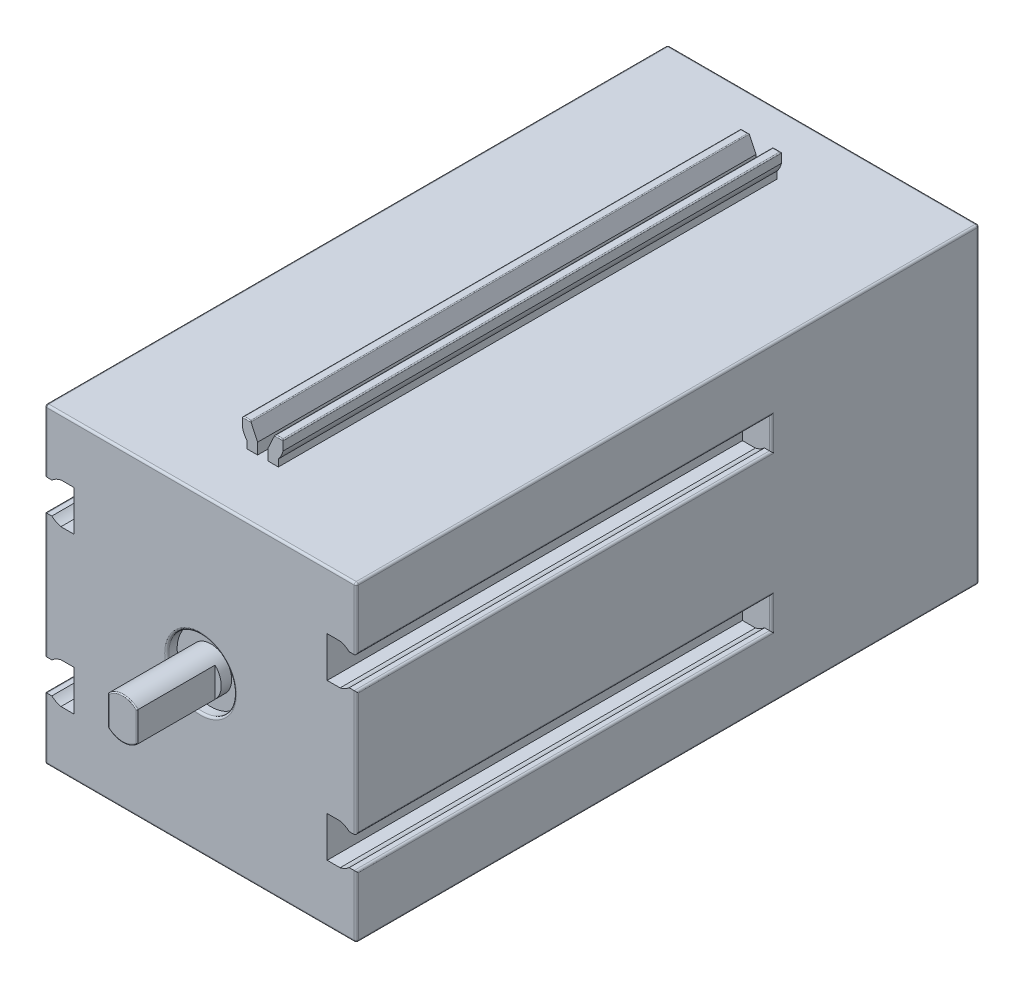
SolidWorks part; units mm, degrees
ref_plane "前视基准面" through (0, 0, 0) normal (0, 0, 1) x (1, 0, 0)
ref_plane "上视基准面" through (0, 0, 0) normal (0, 1, 0) x (1, 0, 0)
ref_plane "右视基准面" through (0, 0, 0) normal (1, 0, 0) x (0, 0, -1)
sketch "草图1" plane through (0, 0, 0) normal (0, 0, 1) x (1, 0, 0)
  line L1 (-15, 0) -> (15, 0)
  line L2 (-15, 0) -> (-15, 30)
  line L3 (-15, 30) -> (15, 30)
  line L4 (15, 0) -> (15, 30)
extrude "凸台-拉伸1" add sketch "草图1" against normal blind 60
sketch "草图2" plane through (0, 0, -60) normal (0, 0, -1) x (-1, 0, 0)
  line L0 (-9, 0.6771) -> (-9, 0)
  line L1 (15, 0) -> (-15, 0) construction
  line L2 (0, -2.0675) -> (0, 3.9748) construction
  line L3 (-6, 0.6771) -> (-6, 0)
  line L4 (-6, 0) -> (-9, 0)
  line L5 (-9.45, 2.8) -> (-5.55, 2.8)
  line L6 (-9.45, 2.8) -> (-9.45, 1.5556)
  line L7 (5.55, 2.8) -> (5.55, 1.5556)
  line L8 (-5.55, 2.8) -> (-5.55, 1.5556)
  line L9 (9.45, 2.8) -> (9.45, 1.5556)
  line L10 (9.45, 2.8) -> (5.55, 2.8)
  line L11 (6, 0) -> (9, 0)
  line L12 (6, 0.6771) -> (6, 0)
  line L13 (9, 0.6771) -> (9, 0)
  arc A0 (9.45, 1.5556) -> (9, 0.6771) centre (7.5, 2) cw
  arc A1 (-6, 0.6771) -> (-5.55, 1.5556) centre (-7.5, 2) ccw
  arc A2 (-9.45, 1.5556) -> (-9, 0.6771) centre (-7.5, 2) ccw
  arc A3 (6, 0.6771) -> (5.55, 1.5556) centre (7.5, 2) cw
extrude "切除-拉伸1" cut sketch "草图2" against normal blind 54.5
sketch "草图3" plane through (0, 0, -60) normal (0, 0, -1) x (-1, 0, 0)
  line L0 (-14.3229, 9) -> (-15, 9)
  line L1 (-15, 0) -> (-15, 30) construction
  line L2 (-15, 6) -> (-14.3229, 6)
  line L3 (-12.2, 9.45) -> (-12.2, 5.55)
  line L4 (-15, 9) -> (-15, 6)
  line L5 (-12.2, 5.55) -> (-13.4444, 5.55)
  line L6 (-12.2, 9.45) -> (-13.4444, 9.45)
  line L8 (-12.2, 20.55) -> (-13.4444, 20.55)
  line L9 (-12.2, 24.45) -> (-13.4444, 24.45)
  line L10 (-15, 21) -> (-15, 24)
  line L11 (-12.2, 20.55) -> (-12.2, 24.45)
  line L12 (-15, 24) -> (-14.3229, 24)
  line L13 (-14.3229, 21) -> (-15, 21)
  line L15 (14.3229, 21) -> (15, 21)
  line L16 (15, 24) -> (14.3229, 24)
  line L17 (12.2, 20.55) -> (12.2, 24.45)
  line L18 (15, 21) -> (15, 24)
  line L19 (12.2, 24.45) -> (13.4444, 24.45)
  line L20 (12.2, 20.55) -> (13.4444, 20.55)
  line L21 (12.2, 9.45) -> (13.4444, 9.45)
  line L22 (12.2, 5.55) -> (13.4444, 5.55)
  line L23 (15, 9) -> (15, 6)
  line L24 (12.2, 9.45) -> (12.2, 5.55)
  line L25 (15, 6) -> (14.3229, 6)
  line L26 (14.3229, 9) -> (15, 9)
  arc A0 (-14.3229, 6) -> (-13.4444, 5.55) centre (-13, 7.5) ccw
  arc A1 (-13.4444, 9.45) -> (-14.3229, 9) centre (-13, 7.5) ccw
  arc A2 (-13.4444, 20.55) -> (-14.3229, 21) centre (-13, 22.5) cw
  arc A3 (-14.3229, 24) -> (-13.4444, 24.45) centre (-13, 22.5) cw
  arc A4 (14.3229, 24) -> (13.4444, 24.45) centre (13, 22.5) ccw
  arc A5 (13.4444, 20.55) -> (14.3229, 21) centre (13, 22.5) ccw
  arc A6 (13.4444, 9.45) -> (14.3229, 9) centre (13, 7.5) cw
  arc A7 (14.3229, 6) -> (13.4444, 5.55) centre (13, 7.5) cw
extrude "切除-拉伸2" cut sketch "草图3" along normal blind 40 from offset 60
sketch "草图5" plane through (0, 0, -60) normal (0, 0, -1) x (-1, 0, 0)
  line L0 (-1.5, 30.6771) -> (-1.5, 30)
  line L1 (-15, 30) -> (15, 30) construction
  line L2 (1.5, 30) -> (1.5, 30.6771)
  line L3 (-1.95, 32.5) -> (-1.1658, 32.5)
  line L4 (-1.95, 32.5) -> (-1.95, 31.5556)
  line L5 (1.95, 32.5) -> (1.95, 31.5556)
  line L6 (-1.5, 30) -> (-0.5, 30)
  line L7 (-0.5, 30) -> (-0.5, 31.0723)
  line L8 (0.5, 30) -> (0.5, 31.0723)
  line L9 (-0.5, 31.0723) -> (-1.1658, 32.5)
  line L10 (0.5, 31.0723) -> (1.1658, 32.5)
  line L11 (1.1658, 32.5) -> (1.95, 32.5)
  line L12 (0.5, 30) -> (1.5, 30)
  arc A1 (-1.95, 31.5556) -> (-1.5, 30.6771) centre (0, 32) ccw
  arc A2 (1.5, 30.6771) -> (1.95, 31.5556) centre (0, 32) ccw
extrude "凸台-拉伸2" add sketch "草图5" against normal blind 48 from offset 6
fillet "圆角1" radius 0.1 8 edges at (-1.1658, 32.5, -30) (-1.5579, 32.5, -6) (-1.95, 32.5, -30) (-1.5579, 32.5, -54) (1.95, 32.5, -30) (1.5579, 32.5, -6) (1.1658, 32.5, -30) (1.5579, 32.5, -54)
sketch "草图6" plane through (0, 0, 0) normal (0, 0, 1) x (1, 0, 0)
  circle A0 centre (0, 15) radius 3.25
extrude "切除-拉伸3" cut sketch "草图6" against normal blind 1
sketch "草图7" plane through (0, 0, -1) normal (0, 0, 1) x (1, 0, 0)
  circle A0 centre (0, 15) radius 2
extrude "凸台-拉伸3" add sketch "草图7" along normal blind 8.5
sketch "草图9" plane through (0, 0, 7.5) normal (0, 0, 1) x (1, 0, 0)
  line L2 (-1.4, 16.4283) -> (-1.4, 13.5717)
  line L4 (1.4, 16.4283) -> (1.4, 13.5717)
  arc A3 (-1.4, 16.4283) -> (-1.4, 13.5717) centre (0, 15) ccw
  arc A4 (1.4, 13.5717) -> (1.4, 16.4283) centre (0, 15) ccw
extrude "切除-拉伸5" cut sketch "草图9" against normal up to surface (7.5 mm away)
sketch "草图10" plane through (0, 0, -60) normal (0, 0, -1) x (-1, 0, 0)
  circle A0 centre (-10.5, 25.5) radius 1.25
  circle A1 centre (10.5, 25.5) radius 1.25
extrude "切除-拉伸6" cut sketch "草图10" against normal blind 5
sketch "草图11" plane through (0, 0, -60) normal (0, 0, -1) x (-1, 0, 0)
  line L0 (2.5, 24) -> (4, 24)
  line L1 (-4, 27) -> (4, 27)
  line L2 (-4, 27) -> (-4, 24)
  line L3 (-4, 24) -> (-2.5, 24)
  line L4 (4, 27) -> (4, 24)
  line L6 (-2.5, 24) -> (-2.5, 25)
  line L7 (-2.5, 25) -> (2.5, 25)
  line L8 (2.5, 24) -> (2.5, 25)
extrude "切除-拉伸7" cut sketch "草图11" against normal blind 5
fillet "圆角2" radius 0.2 37 edges at (-12, 0, -60) (0, 0, 0) (12, 0, -60) (9, 0, -32.75) (7.5, 0, -5.5) (6, 0, -32.75) (0, 0, -60) (-6, 0, -32.75) (-7.5, 0, -5.5) (-9, 0, -32.75) (-15, 0, -30) (-15, 15, -60) (-15, 30, -30) (-15, 27, 0) (-15, 24, -20) (-15, 22.5, -40) (-15, 21, -20) (-15, 15, 0) (-15, 9, -20) (-15, 7.5, -40) (-15, 6, -20) (-15, 3, 0) (15, 30, -30) (15, 15, -60) (15, 0, -30) (15, 3, 0) (15, 6, -20) (15, 7.5, -40) (15, 9, -20) (15, 15, 0) (15, 21, -20) (15, 22.5, -40) (15, 24, -20) (15, 27, 0) (0, 30, -60) (3.25, 15, 0) (0, 30, 0)
fillet "圆角3" radius 0.1 4 edges at (0, 13, 7.5) (0, 17, 7.5) (1.4, 15, 7.5) (-1.4, 15, 7.5)
